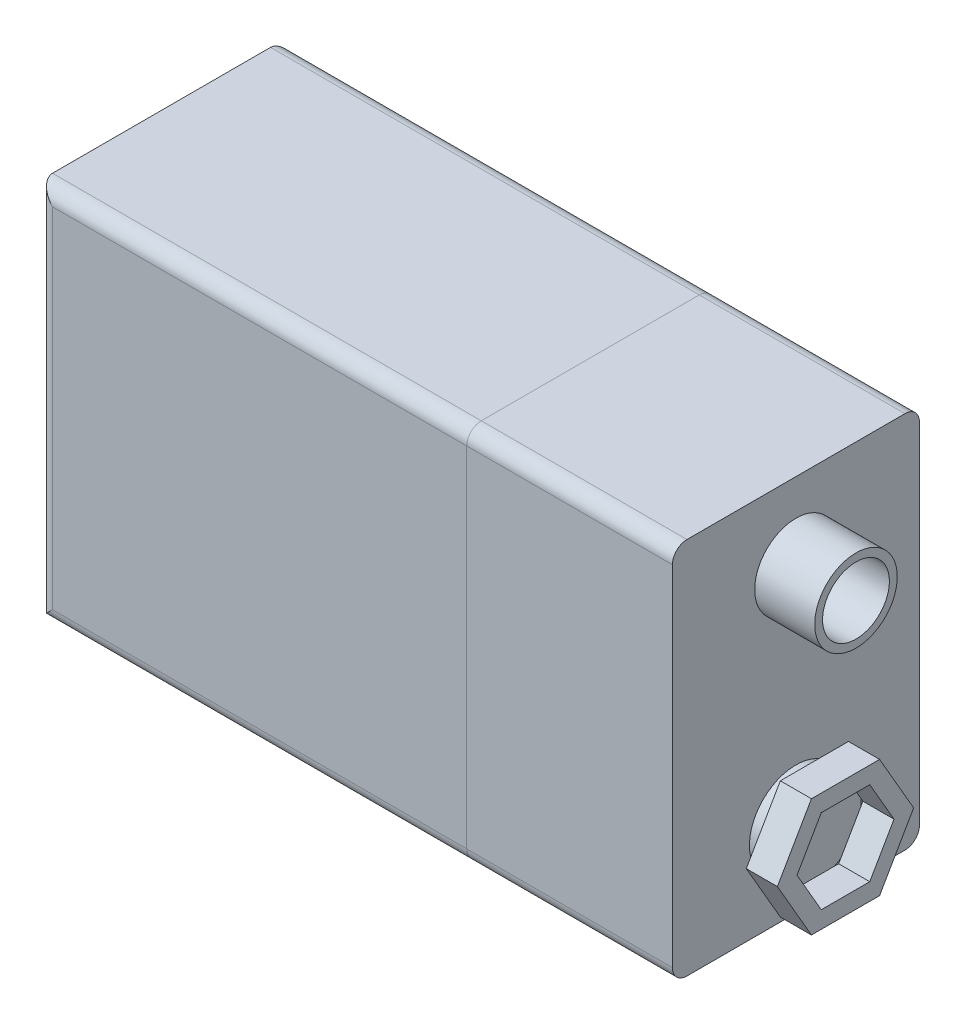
SolidWorks part; units mm, degrees
ref_plane "Front Plane" through (0, 0, 0) normal (0, 0, 1) x (1, 0, 0)
ref_plane "Top Plane" through (0, 0, 0) normal (0, 1, 0) x (1, 0, 0)
ref_plane "Right Plane" through (0, 0, 0) normal (1, 0, 0) x (0, 0, -1)
sketch "Sketch2" plane through (0, 0, 0) normal (0, 1, 0) x (1, 0, 0)
  line L0 (0, 0) -> (29.5, 0)
  line L1 (-55, 0) -> (55, 0) construction
  line L2 (29.5, 0) -> (29.5, 17)
  line L3 (29.5, 17) -> (0, 17)
  line L4 (0, -55) -> (0, 55) construction
  line L5 (0, 17) -> (0, 0)
  dimension "D1" = 29.5
  dimension "D2" = 17
extrude "Boss-Extrude1" add sketch "Sketch2" along normal blind 26.008
sketch "Sketch7" plane through (29.5, 0, 0) normal (1, 0, 0) x (0, 0, -1)
  line L1 (0, 26.008) -> (17, 26.008)
  line L2 (0, 26.008) -> (0, 0)
  line L3 (0, 0) -> (17, 0)
  line L4 (17, 26.008) -> (17, 0)
extrude "Boss-Extrude3" add sketch "Sketch7" along normal blind 14.15 separate body
sketch "Sketch8" plane through (43.65, 0, 0) normal (1, 0, 0) x (0, 0, -1)
  line L7 (8.5, 26.008) -> (8.5, 0) construction
  line L8 (17, 26.008) -> (0, 26.008) construction
  circle A0 centre (8.5, 20.688) radius 2.84
  circle A2 centre (8.5, 20.688) radius 2.3
  dimension "D1" = 5.68
  dimension "D2" = 4.6
  dimension "D3" = 5.32
extrude "Boss-Extrude4" add sketch "Sketch8" along normal blind 4.13
sketch "Sketch9" plane through (43.65, 0, 0) normal (1, 0, 0) x (0, 0, -1)
  line L0 (8.5, 26.008) -> (8.5, 0) construction
  line L1 (17, 26.008) -> (0, 26.008) construction
  line L2 (0, 0) -> (17, 0) construction
  circle A0 centre (8.5, 5.63) radius 3.2
  dimension "D1" = 6.4
  dimension "D2" = 5.63
extrude "Boss-Extrude5" add sketch "Sketch9" along normal blind 1.27
sketch "Sketch10" plane through (44.92, 0, 0) normal (1, 0, 0) x (0, 0, -1)
  line L1 (13.1881, 5.63) -> (10.844, 9.69)
  line L2 (10.844, 9.69) -> (6.156, 9.69)
  line L3 (6.156, 9.69) -> (3.8119, 5.63)
  line L4 (3.8119, 5.63) -> (6.156, 1.57)
  line L5 (6.156, 1.57) -> (10.844, 1.57)
  line L6 (10.844, 1.57) -> (13.1881, 5.63)
  line L7 (11.8371, 5.63) -> (10.1685, 8.52)
  line L8 (10.1685, 8.52) -> (6.8315, 8.52)
  line L9 (6.8315, 8.52) -> (5.1629, 5.63)
  line L10 (5.1629, 5.63) -> (6.8315, 2.74)
  line L11 (6.8315, 2.74) -> (10.1685, 2.74)
  line L12 (10.1685, 2.74) -> (11.8371, 5.63)
  circle A0 centre (8.5, 5.63) radius 4.06 construction
  circle A1 centre (8.5, 5.63) radius 3.2 construction
  circle A2 centre (8.5, 5.63) radius 2.89 construction
  dimension "D1" = 8.12
  dimension "D2" = 5.78
extrude "Boss-Extrude6" add sketch "Sketch10" along normal blind 2.14
fillet "Fillet1" radius 1 4 edges at (36.575, 0, 0) (36.575, 0, -17) (36.575, 26.008, -17) (36.575, 26.008, 0)
fillet "Fillet2" radius 1 6 edges at (14.75, 0, 0) (0, 13.004, 0) (14.75, 26.008, 0) (14.75, 0, -17) (0, 13.004, -17) (14.75, 26.008, -17)
